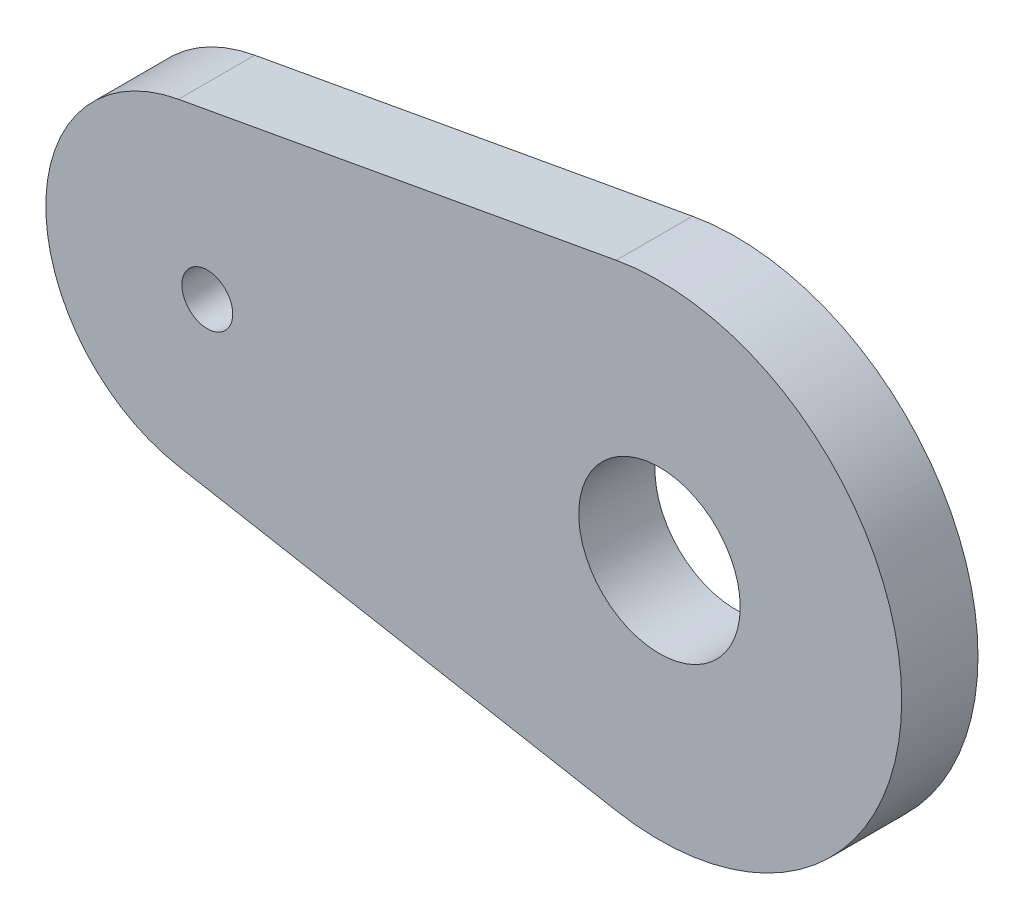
SolidWorks part; units mm, degrees
ref_plane "Front Plane" through (0, 0, 0) normal (0, 0, 1) x (1, 0, 0)
ref_plane "Top Plane" through (0, 0, 0) normal (0, 1, 0) x (1, 0, 0)
ref_plane "Right Plane" through (0, 0, 0) normal (1, 0, 0) x (0, 0, -1)
sketch "Sketch1" plane through (0, 0, 0) normal (0, 0, 1) x (1, 0, 0)
  line L0 (-1.1339, 6.2479) -> (16.0791, 9.3719)
  line L5 (-1.1339, -6.2479) -> (16.0791, -9.3719)
  circle A4 centre (0, 0) radius 1
  circle A5 centre (17.78, 0) radius 3.175
  arc A6 (-1.1339, 6.2479) -> (-1.1339, -6.2479) centre (0, 0) ccw
  arc A7 (16.0791, 9.3719) -> (16.0791, -9.3719) centre (17.78, 0) cw
  dimension "D3" = 17.78
  dimension "D1" = 6.35
  dimension "D2" = 2
  dimension "D4" = 6.35
  dimension "D5" = 9.525
extrude "Boss-Extrude1" add sketch "Sketch1" along normal blind 3
